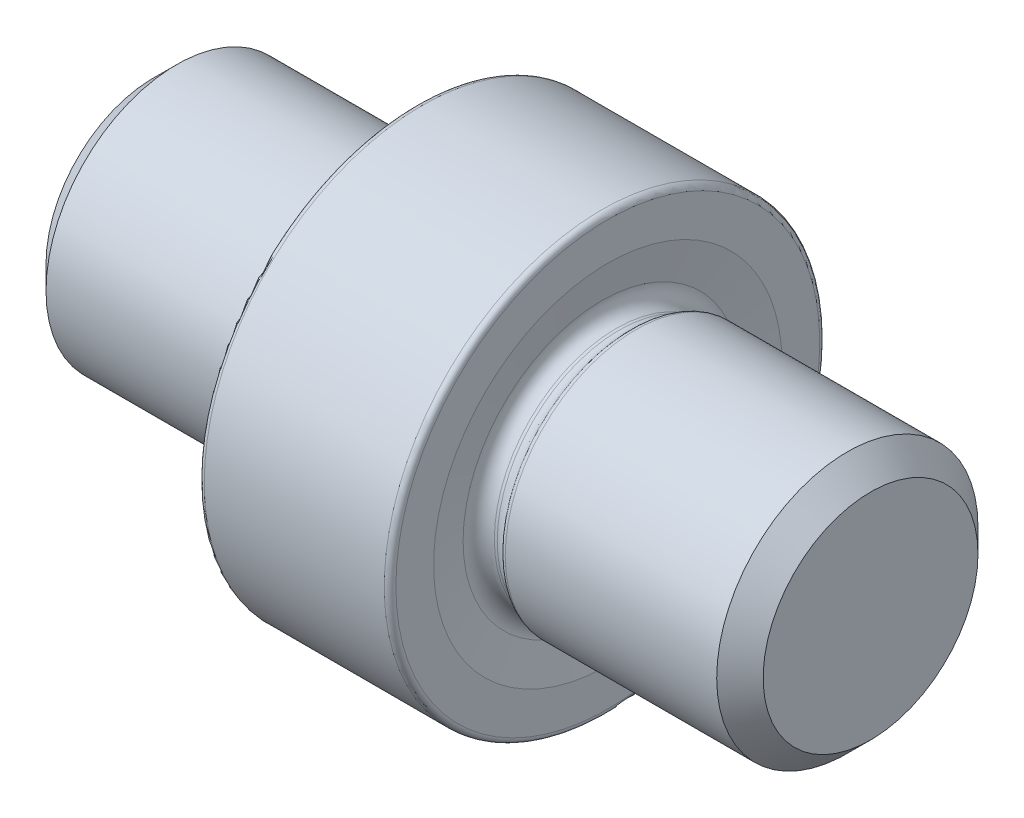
SolidWorks part; units mm, degrees
ref_plane "Přední rovina" through (0, 0, 0) normal (0, 0, 1) x (1, 0, 0)
ref_plane "Horní rovina" through (0, 0, 0) normal (0, 1, 0) x (1, 0, 0)
ref_plane "Pravá rovina" through (0, 0, 0) normal (1, 0, 0) x (0, 0, -1)
sketch "Skica1" plane through (0, 0, 0) normal (0, 0, 1) x (1, 0, 0)
  line L0 (0, 0) -> (0, 7.5) construction
  line L1 (-3.3, 7.5) -> (3.3, 7.5)
  line L2 (3.3, 7.5) -> (3.3, 6)
  line L3 (4.15, 4.5) -> (12.35, 4.5)
  line L4 (12.35, 4.5) -> (12.35, 0)
  line L5 (12.35, 0) -> (-12.35, 0)
  line L6 (-12.35, 4.5) -> (-12.35, 0)
  line L7 (-4.15, 4.2) -> (-4.15, 4.5)
  line L8 (-3, 4.2) -> (-4.15, 4.2)
  line L9 (-3.3, 6) -> (-3, 4.2)
  line L10 (3.3, 6) -> (3, 4.2)
  line L11 (3, 4.2) -> (4.15, 4.2)
  line L12 (4.15, 4.2) -> (4.15, 4.5)
  line L13 (-4.15, 4.5) -> (-12.35, 4.5)
  line L14 (-3.3, 7.5) -> (-3.3, 6)
  dimension "D1" = 24.7
  dimension "D2" = 6.6
  dimension "D3" = 4.5
  dimension "D4" = 7.5
  dimension "D5" = 1.5
  dimension "D6" = 0.3
  dimension "D7" = 0.3
  dimension "D8" = 8.2
revolve "Rotovat1" add sketch "Skica1" angle 360 about L5
fillet "Zaoblit1" radius 0.5 4 edges at (-4.15, 0, -4.2) (4.15, 0, -4.2) (-3, 0, -4.2) (3, 0, -4.2)
fillet "Zaoblit2" radius 0.2 2 edges at (-4.15, 0, -4.5) (4.15, 0, -4.5)
chamfer "Zkosení1" distance 0.8 angle 45 2 edges at (12.35, 0, -4.5) (-12.35, 0, -4.5)
fillet "Zaoblit3" radius 0.2 2 edges at (3.3, 0, -7.5) (-3.3, 0, -7.5)
